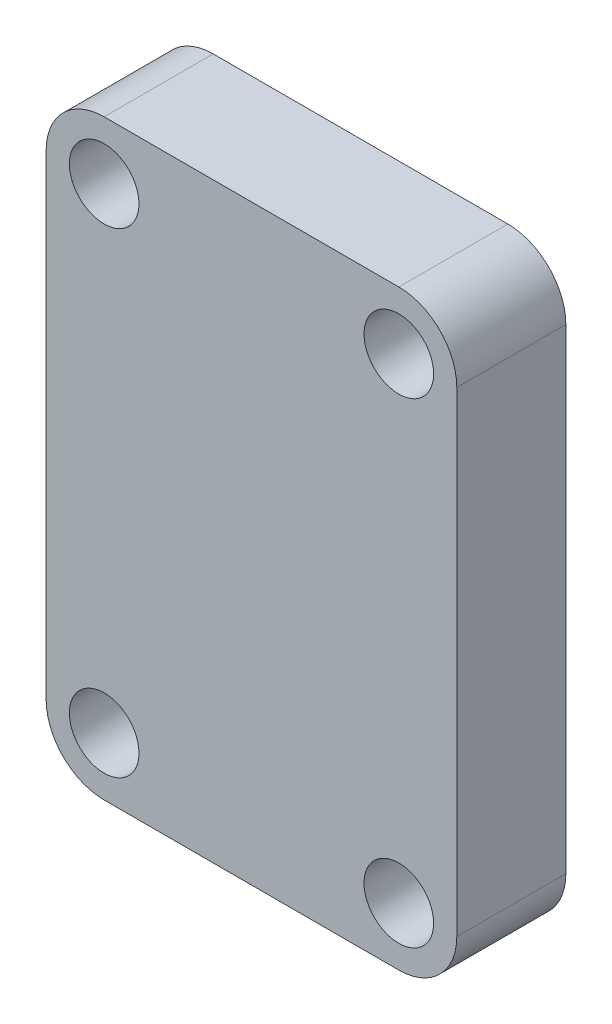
SolidWorks part; units mm, degrees
ref_plane "Front Plane" through (0, 0, 0) normal (0, 0, 1) x (1, 0, 0)
ref_plane "Top Plane" through (0, 0, 0) normal (0, 1, 0) x (1, 0, 0)
ref_plane "Right Plane" through (0, 0, 0) normal (1, 0, 0) x (0, 0, -1)
sketch "Sketch1" plane through (0, 0, 0) normal (0, 0, 1) x (1, 0, 0)
  line L1 (6.35, -12.75) -> (-6.35, -12.75)
  line L2 (8.85, -10.25) -> (8.85, 10.25)
  line L3 (6.35, 12.75) -> (-6.35, 12.75)
  line L4 (-8.85, -10.25) -> (-8.85, 10.25)
  line L5 (8.85, -12.75) -> (-8.85, 12.75) construction
  line L6 (8.85, 12.75) -> (-8.85, -12.75) construction
  circle A0 centre (-6.35, 10.25) radius 1.5
  circle A1 centre (6.35, 10.25) radius 1.5
  circle A2 centre (-6.35, -10.25) radius 1.5
  circle A3 centre (6.35, -10.25) radius 1.5
  arc A4 (-6.35, 12.75) -> (-8.85, 10.25) centre (-6.35, 10.25) ccw
  arc A5 (6.35, -12.75) -> (8.85, -10.25) centre (6.35, -10.25) ccw
  arc A6 (-6.35, -12.75) -> (-8.85, -10.25) centre (-6.35, -10.25) cw
  arc A7 (8.85, 10.25) -> (6.35, 12.75) centre (6.35, 10.25) ccw
  point P0 (0, 0)
  dimension "D3" = 3
  dimension "D4" = 3
  dimension "D5" = 3
  dimension "D6" = 3
  dimension "D15" = 2.5
  dimension "D16" = 2.5
  dimension "D1" = 17.7
  dimension "D2" = 25.5
  dimension "D7" = 2.5
  dimension "D8" = 2.5
  dimension "D9" = 2.5
  dimension "D10" = 2.5
  dimension "D11" = 2.5
  dimension "D12" = 2.5
  dimension "D13" = 2.5
  dimension "D14" = 2.5
extrude "Boss-Extrude1" add sketch "Sketch1" along normal blind 4.7
